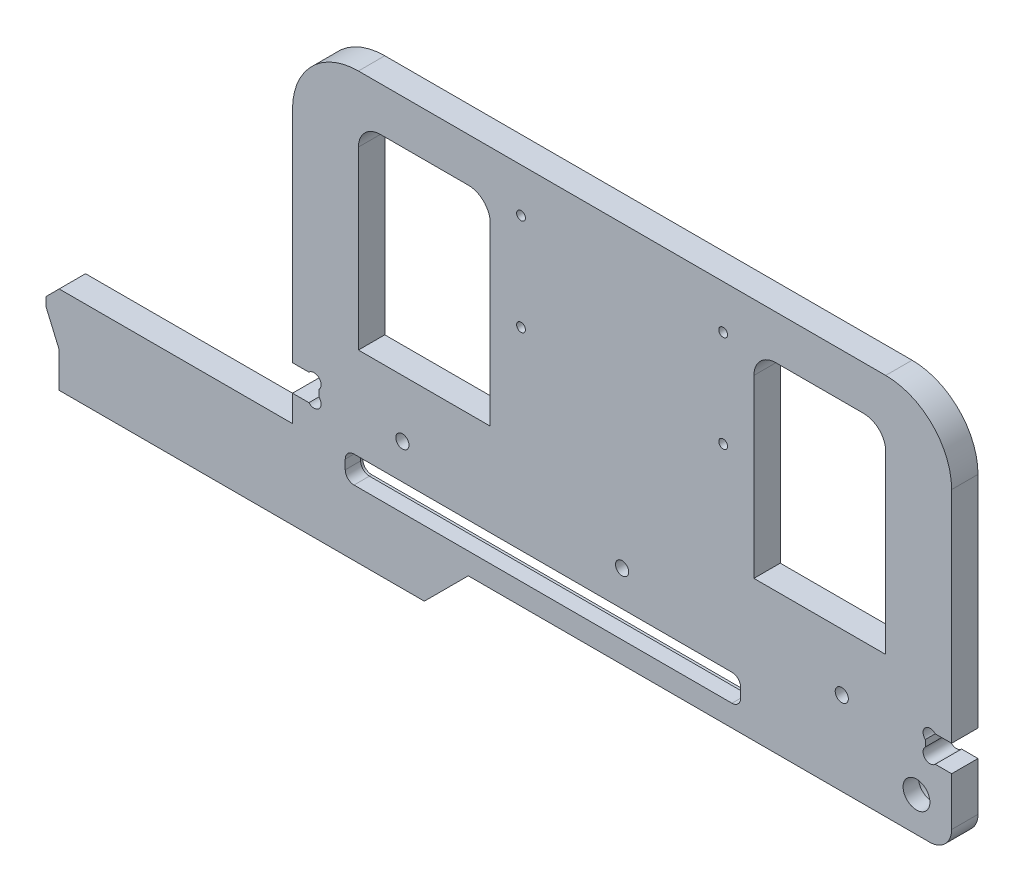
SolidWorks part; units mm, degrees
ref_plane "Face" through (0, 0, 0) normal (0, 0, 1) x (1, 0, 0)
ref_plane "Dessus" through (0, 0, 0) normal (0, 1, 0) x (1, 0, 0)
ref_plane "Droite" through (0, 0, 0) normal (1, 0, 0) x (0, 0, -1)
sketch "Esquisse1" plane through (0, 0, 0) normal (0, 0, 1) x (1, 0, 0)
  line L1 (-78.3614, 54.1636) -> (71.6386, 54.1636)
  line L2 (-78.3614, 54.1636) -> (-78.3614, -32.8364)
  line L3 (-78.3614, -32.8364) -> (71.6386, -32.8364)
  line L4 (71.6386, 54.1636) -> (71.6386, -32.8364)
  dimension "D1" = 150
  dimension "D2" = 87
extrude "Base-Extrusion" add sketch "Esquisse1" along normal blind 6
sketch "Esquisse2" plane through (0, 0, 6) normal (0, 0, 1) x (1, 0, 0)
  line L0 (71.6386, -32.8364) -> (71.6386, 54.1636) construction
  line L1 (-78.3614, -32.8364) -> (71.6386, -32.8364) construction
  line L2 (-78.3614, 54.1636) -> (-78.3614, -32.8364) construction
  line L3 (-66.3614, -21.8364) -> (23.6386, -21.8364)
  line L4 (-66.3614, -21.8364) -> (-66.3614, -27.9364)
  line L5 (-66.3614, -27.9364) -> (23.6386, -27.9364)
  line L6 (23.6386, -21.8364) -> (23.6386, -27.9364)
  circle A0 centre (63.6386, -24.9364) radius 3.05
  circle A1 centre (-53.3614, -13.8364) radius 1.5
  circle A2 centre (-3.3614, -13.8364) radius 1.5
  circle A3 centre (46.6386, -13.8364) radius 1.5
  dimension "D1" = 6.1
  dimension "D11" = 3
  dimension "D12" = 3
  dimension "D13" = 3
  dimension "D2" = 8
  dimension "D3" = 7.9
  dimension "D4" = 90
  dimension "D5" = 6.1
  dimension "D6" = 4.9
  dimension "D7" = 12
  dimension "D8" = 19
  dimension "D9" = 19
  dimension "D10" = 19
  dimension "D14" = 25
  dimension "D15" = 25
  dimension "D16" = 75
extrude "Enlèv. mat.-Extru.1" cut sketch "Esquisse2" against normal up to vertex (6 mm away)
fillet "Congé1" radius 2 4 edges at (-66.3614, -27.9364, 3) (-66.3614, -21.8364, 3) (23.6386, -21.8364, 3) (23.6386, -27.9364, 3)
sketch "Esquisse4" plane through (0, 0, 6) normal (0, 0, 1) x (1, 0, 0)
  line L0 (-78.3614, 54.1636) -> (-78.3614, -32.8364) construction
  line L1 (71.6386, -32.8364) -> (71.6386, 54.1636) construction
  line L5 (26.6386, 44.1636) -> (56.6386, 44.1636)
  line L6 (26.6386, 44.1636) -> (26.6386, -0.8364)
  line L7 (26.6386, -0.8364) -> (56.6386, -0.8364)
  line L8 (56.6386, 44.1636) -> (56.6386, -0.8364)
  line L9 (-63.3614, 44.1636) -> (-33.3614, 44.1636)
  line L10 (-63.3614, 44.1636) -> (-63.3614, -0.8364)
  line L11 (-63.3614, -0.8364) -> (-33.3614, -0.8364)
  line L12 (-33.3614, 44.1636) -> (-33.3614, -0.8364)
  line L13 (71.6386, 54.1636) -> (-78.3614, 54.1636) construction
  dimension "D2" = 30
  dimension "D3" = 30
  dimension "D4" = 15
  dimension "D5" = 45
  dimension "D6" = 45
  dimension "D7" = 15
  dimension "D9" = 10
  dimension "D11" = 10
extrude "Enlèv. mat.-Extru.3" cut sketch "Esquisse4" against normal up to vertex (6 mm away)
fillet "Congé3" radius 5 4 edges at (26.6386, 44.1636, 3) (56.6386, 44.1636, 3) (-63.3614, 44.1636, 3) (-33.3614, 44.1636, 3)
fillet "Congé4" radius 15 2 edges at (-78.3614, 54.1636, 3) (71.6386, 54.1636, 3)
sketch "Esquisse5" plane through (0, 0, 6) normal (0, 0, 1) x (1, 0, 0)
  line L0 (71.6386, -32.8364) -> (71.6386, 39.1636) construction
  line L1 (65.6386, -10.8364) -> (71.6386, -10.8364)
  line L2 (65.6386, -10.8364) -> (65.6386, -16.8364)
  line L3 (65.6386, -16.8364) -> (71.6386, -16.8364)
  line L4 (71.6386, -10.8364) -> (71.6386, -16.8364)
  line L5 (-78.3614, 39.1636) -> (-78.3614, -32.8364) construction
  line L6 (-78.3614, -10.8364) -> (-72.3614, -10.8364)
  line L7 (-78.3614, -10.8364) -> (-78.3614, -16.8364)
  line L8 (-78.3614, -16.8364) -> (-72.3614, -16.8364)
  line L9 (-72.3614, -10.8364) -> (-72.3614, -16.8364)
  line L10 (-78.3614, -32.8364) -> (71.6386, -32.8364) construction
  dimension "D1" = 6
  dimension "D2" = 6
  dimension "D3" = 6
  dimension "D4" = 6
  dimension "D5" = 16
  dimension "D6" = 16
extrude "Enlèv. mat.-Extru.4" cut sketch "Esquisse5" against normal up to vertex (6 mm away)
fillet "Congé5" radius 5 1 edges at (71.6386, -32.8364, 3)
sketch "Esquisse7" plane through (0, 0, 6) normal (0, 0, 1) x (1, 0, 0)
  line L0 (-72.3614, -16.8364) -> (-72.3614, -10.8364) construction
  line L1 (-72.3614, -10.8364) -> (-78.3614, -10.8364) construction
  line L2 (-78.3614, -16.8364) -> (-72.3614, -16.8364) construction
  line L3 (65.6386, -10.8364) -> (65.6386, -16.8364) construction
  line L4 (71.6386, -10.8364) -> (65.6386, -10.8364) construction
  line L5 (65.6386, -16.8364) -> (71.6386, -16.8364) construction
  circle A0 centre (-73.4614, -11.9364) radius 1.6
  circle A1 centre (-73.4614, -15.7364) radius 1.6
  circle A2 centre (66.7386, -11.9364) radius 1.6
  circle A3 centre (66.7386, -15.7364) radius 1.6
  dimension "D1" = 1.1
  dimension "D5" = 1.1
  dimension "D2" = 1.1
  dimension "D3" = 1.1
  dimension "D4" = 1.1
  dimension "D6" = 1.1
  dimension "D7" = 1.1
  dimension "D8" = 1.1
extrude "Enlèv. mat.-Extru.5" cut sketch "Esquisse7" against normal up to vertex (6 mm away)
sketch "Esquisse8" plane through (0, 0, 6) normal (0, 0, 1) x (1, 0, 0)
  line L0 (-78.3614, -32.8364) -> (-78.3614, -42.8364)
  line L1 (-78.3614, -42.8364) -> (-48.3614, -42.8364)
  line L2 (-48.3614, -42.8364) -> (-38.3614, -32.8364)
  line L3 (-78.3614, -32.8364) -> (66.6386, -32.8364) construction
  line L4 (-38.3614, -32.8364) -> (-78.3614, -32.8364)
  dimension "D1" = 40
  dimension "D2" = 30
  dimension "D3" = 10
extrude "Extrusion1" add sketch "Esquisse8" against normal up to vertex (6 mm away)
sketch "Esquisse10" plane through (-78.3614, 0, 0) normal (-1, 0, 0) x (0, 0, 1)
  line L1 (0, -16.8364) -> (0, -42.8364) construction
  line L2 (0, -22.8364) -> (6, -22.8364)
  line L3 (0, -22.8364) -> (0, -42.8364)
  line L4 (0, -42.8364) -> (6, -42.8364)
  line L5 (6, -22.8364) -> (6, -42.8364)
  line L6 (6, -16.8364) -> (6, -42.8364) construction
  line L7 (0, -42.8364) -> (6, -42.8364) construction
  dimension "D1" = 20
  dimension "D2" = 20
extrude "Extrusion2" add sketch "Esquisse10" along normal blind 56.1
chamfer "Chanfrein1" distance 3 angle 45 1 edges at (-134.4614, -22.8364, 3)
sketch "Esquisse11" plane through (0, 0, 6) normal (0, 0, 1) x (1, 0, 0)
  line L0 (-131.4614, -42.8364) -> (-131.4614, -34.8364)
  line L1 (-134.4614, -42.8364) -> (-48.3614, -42.8364) construction
  line L2 (-131.4614, -34.8364) -> (-134.4614, -27.8364)
  line L3 (-134.4614, -42.8364) -> (-134.4614, -25.8364) construction
  line L4 (-134.4614, -27.8364) -> (-138.7193, -27.8364)
  line L5 (-138.7193, -27.8364) -> (-138.7193, -47.2494)
  line L6 (-138.7193, -47.2494) -> (-131.4614, -47.2494)
  line L7 (-131.4614, -47.2494) -> (-131.4614, -42.8364)
  dimension "D1" = 8
  dimension "D2" = 7
extrude "Enlèv. mat.-Extru.6" cut sketch "Esquisse11" against normal through all
sketch "Esquisse12" plane through (0, 0, 0) normal (0, 0, -1) x (-1, 0, 0)
  line L0 (78.3614, -16.8364) -> (78.3614, -22.8364) construction
  line L1 (-25.6386, -19.8864) -> (68.3614, -19.8864)
  line L2 (-25.6386, -19.8864) -> (-25.6386, -29.8864)
  line L3 (-25.6386, -29.8864) -> (68.3614, -29.8864)
  line L4 (68.3614, -19.8864) -> (68.3614, -29.8864)
  line L5 (-21.6386, -21.8364) -> (64.3614, -21.8364) construction
  circle A0 centre (-63.6386, -24.9364) radius 5
  circle A1 centre (-46.6386, -13.8364) radius 3.25
  circle A2 centre (3.3614, -13.8364) radius 3.25
  circle A3 centre (53.3614, -13.8364) radius 3.25
  dimension "D1" = 10
  dimension "D2" = 94
  dimension "D3" = 10
  dimension "D4" = 1.95
extrude "Enlèv. mat.-Extru.7" cut sketch "Esquisse12" against normal blind 2.5
fillet "Congé6" radius 2 4 edges at (-68.3614, -19.8864, 1.25) (-68.3614, -29.8864, 1.25) (25.6386, -29.8864, 1.25) (25.6386, -19.8864, 1.25)
sketch "Esquisse13" plane through (0, 0, 6) normal (0, 0, 1) x (1, 0, 0)
  line L0 (-78.3614, 39.1636) -> (-78.3614, -10.8364) construction
  line L1 (56.6386, 54.1636) -> (-63.3614, 54.1636) construction
  circle A0 centre (-26.3614, 44.1636) radius 1
  circle A1 centre (19.6386, 44.1636) radius 1
  circle A2 centre (-26.3614, 22.1636) radius 1
  circle A3 centre (19.6386, 22.1636) radius 1
  dimension "D1" = 52
  dimension "D3" = 46
  dimension "D4" = 22
  dimension "D2" = 10
extrude "Enlèv. mat.-Extru.8" cut sketch "Esquisse13" against normal through all
